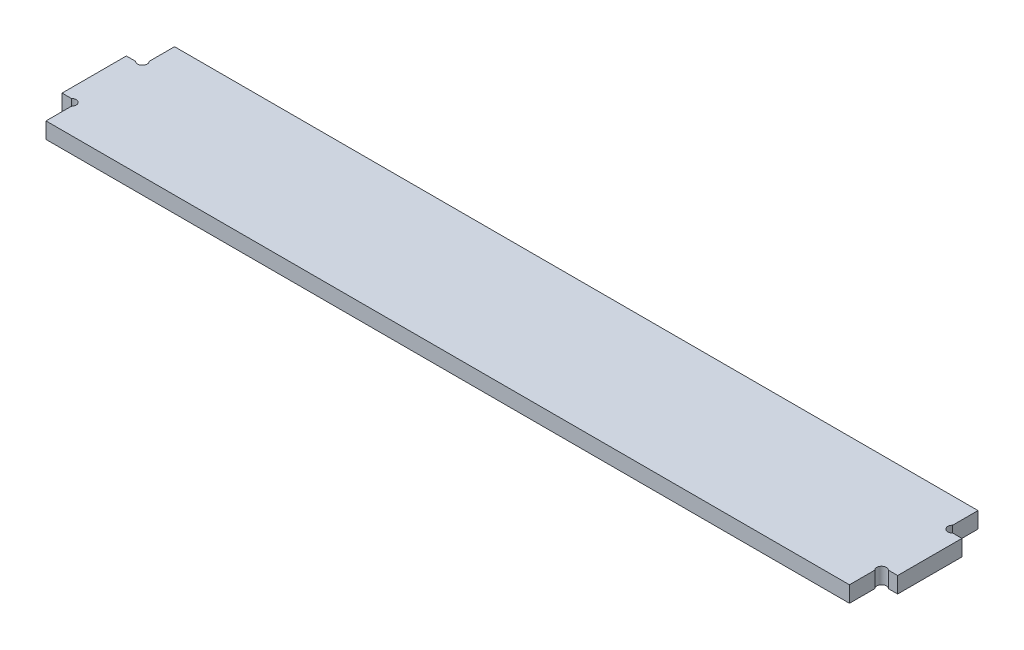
SolidWorks part; units mm, degrees
ref_plane "Alzado" through (0, 0, 0) normal (0, 0, 1) x (1, 0, 0)
ref_plane "Planta" through (0, 0, 0) normal (0, 1, 0) x (1, 0, 0)
ref_plane "Vista lateral" through (0, 0, 0) normal (1, 0, 0) x (0, 0, -1)
sketch "Croquis1" plane through (0, 0, 0) normal (0, 0, 1) x (1, 0, 0)
  line L0 (-500, 173.6398) -> (0, 173.6398)
  line L1 (-500, 173.6398) -> (-500, 163.6398)
  line L2 (0, 173.6398) -> (0, 163.6398)
  line L3 (-500, 163.6398) -> (0, 163.6398)
  dimension "D1" = 10
extrude "Saliente-Extruir1" add sketch "Croquis1" along normal blind 80
sketch "Croquis2" plane through (0, 173.6398, 0) normal (0, 1, 0) x (1, 0, 0)
  line L0 (-531.0877, -40) -> (28.8268, -40) construction
  line L1 (-500, -80) -> (-500, 0) construction
  line L2 (-500, -60) -> (-510, -60)
  line L3 (-500, -60) -> (-500, -20)
  line L4 (-510, -60) -> (-510, -20)
  line L5 (-500, -20) -> (-510, -20)
  point P2 (-251.1305, -40)
  point P5 (-500, -40)
  point P6 (-500, -40)
  dimension "D1" = 40
  dimension "D2" = 10
extrude "Saliente-Extruir2" add sketch "Croquis2" against normal blind 10
sketch "Croquis3" plane through (0, 173.6398, 0) normal (0, 1, 0) x (1, 0, 0)
  line L0 (-502.1213, -17.8787) -> (-502.1213, -20) construction
  line L1 (-500, -20) -> (-510, -20) construction
  line L2 (-502.1213, -17.8787) -> (-500, -17.8787) construction
  line L3 (-500, -20) -> (-500, 0) construction
  line L4 (-510, -40) -> (-484.1472, -40) construction
  line L5 (-510, -20) -> (-510, -60) construction
  circle A0 centre (-502.1213, -17.8787) radius 3
  circle A1 centre (-502.1213, -62.1213) radius 3
  dimension "D1" = 6
extrude "Cortar-Extruir1" cut sketch "Croquis3" against normal through all
ref_plane "Plano1" through (-250, 0, 0) normal (-1, 0, 0) x (0, 0, 1)
mirror "Simetría1" about plane through (-250, 0, 0) normal (-1, 0, 0) of "Saliente-Extruir2", "Cortar-Extruir1"
